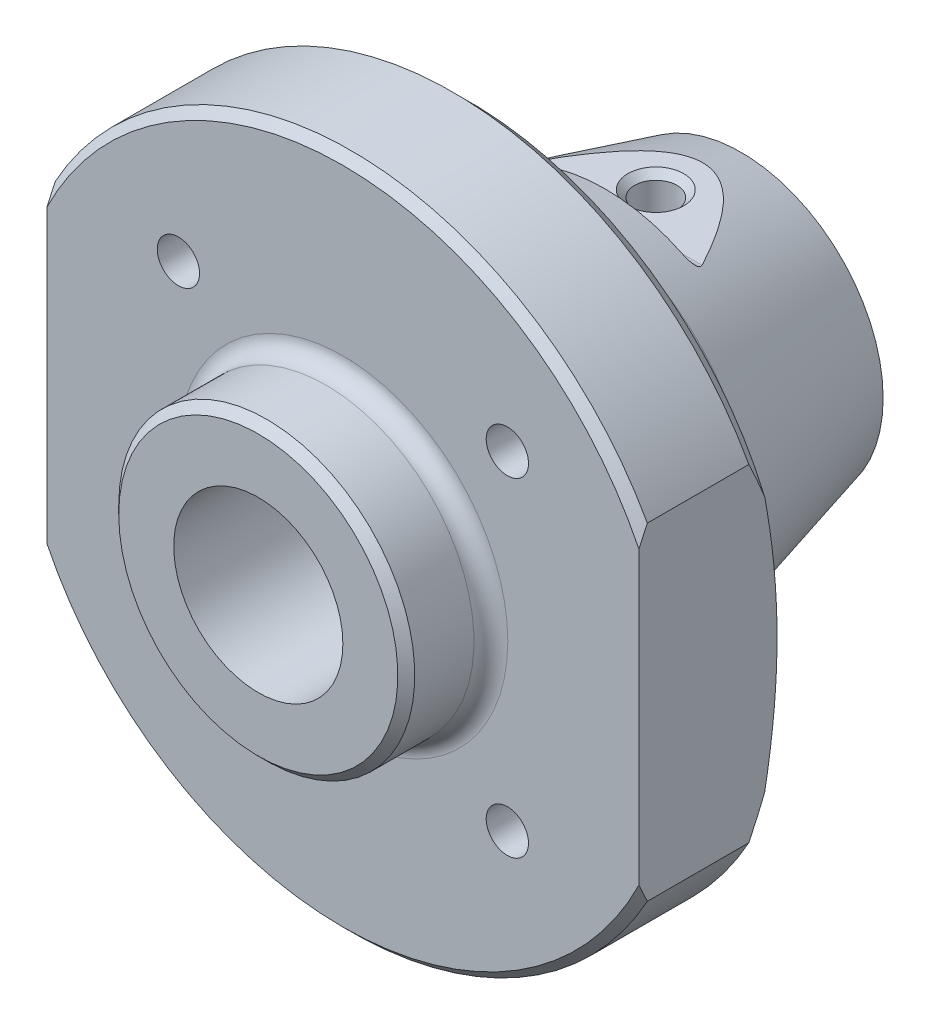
SolidWorks part; units mm, degrees
ref_plane "Front" through (0, 0, 0) normal (0, 0, 1) x (1, 0, 0)
ref_plane "Top" through (0, 0, 0) normal (0, 1, 0) x (1, 0, 0)
ref_plane "Right" through (0, 0, 0) normal (1, 0, 0) x (0, 0, -1)
sketch "Sketch2" plane through (0, 0, 0) normal (0, 1, 0) x (1, 0, 0)
  line L0 (0, 0) -> (0, -23.293) construction
  line L1 (0, 0) -> (17.5, 0)
  line L2 (40, 10) -> (40, 24)
  line L3 (40, 24) -> (23.5966, 31.649)
  line L4 (23.5966, 31.649) -> (16, 60)
  line L5 (16, 60) -> (0, 60)
  line L6 (0, 60) -> (0, 0)
  line L10 (40, 10) -> (17.5, 10)
  line L11 (17.5, 0) -> (17.5, 10)
  dimension "D1" = 80
  dimension "D2" = 35
  dimension "D3" = 65
  dimension "D4" = 32
  dimension "D5" = 60
  dimension "D6" = 75
  dimension "D7" = 10
  dimension "D8" = 24
revolve "Revolve1" add sketch "Sketch2" angle 360 about L0
sketch "Sketch3" plane through (0, 0, -10) normal (0, 0, 1) x (1, 0, 0)
  line L1 (-35, 45) -> (35, 45)
  line L2 (-35, 45) -> (-35, -45)
  line L3 (-35, -45) -> (35, -45)
  line L4 (35, 45) -> (35, -45)
  line L5 (-35, 45) -> (35, -45) construction
  line L6 (-35, -45) -> (35, 45) construction
  point P0 (0, 0)
  dimension "D1" = 70
  dimension "D2" = 90
extrude "Cut-Extrude1" cut sketch "Sketch3" against normal through all flip side to cut
hole_wizard "M6 Tapped Hole1" positions "Sketch5" profile "Sketch4" tap size "M6" standard "ISO"
sketch "Sketch5" plane through (0, 0, -10) normal (0, 0, 1) x (1, 0, 0)
  line L0 (0, 40) -> (0, 0) construction
  line L1 (0, 0) -> (19.4454, 19.4454) construction
  circle A0 centre (0, 0) radius 27.5 construction
  arc A1 (35, 19.3649) -> (-35, 19.3649) centre (0, 0) ccw construction
  point P0 (19.4454, 19.4454)
  dimension "D1" = 55
  dimension "D2" = 45
sketch "Sketch4" plane through (19.4454, 19.4454, -10) normal (1, 0, 0) x (0, -1, 0)
  line L0 (0, 0) -> (0, 16.5022)
  line L1 (0, 16.5022) -> (2.5, 15)
  line L2 (2.5, 15) -> (2.5, 0)
  line L5 (2.5, 0) -> (0, 0)
  line L10 (0, 16.5022) -> (-2.5, 15) construction
  line L11 (0, -6.35) -> (0, 107.95) construction
  dimension "Tap Drill Dia." = 5
  dimension "Tap Drill Depth" = 15
  dimension "Drill Angle" = 118
pattern_circular "CirPattern1" count 4 over 360 about axis through (0, 0, 0) along (0, 0, 1) of "M6 Tapped Hole1"
sketch "Sketch6" plane through (0, 0, 0) normal (0, 0, 1) x (1, 0, 0)
  circle A0 centre (0, 0) radius 10
  dimension "D1" = 20
extrude "Cut-Extrude2" cut sketch "Sketch6" against normal blind 50
fillet "Fillet1" radius 10 1 edges at (-23.5966, 0, -31.649)
chamfer "Chamfer1" distance 3 angle 45 1 edges at (-16, 0, -60)
chamfer "Chamfer2" distance 1 angle 45 4 edges at (0, 40, -10) (0, -40, -10) (0, -40, -24) (0, 40, -24)
chamfer "Chamfer3" distance 1 angle 45 1 edges at (-17.5, 0, 0)
fillet "Fillet3" radius 2 1 edges at (-17.5, 0, -10)
sketch "Sketch8" plane through (0, 0, 0) normal (1, 0, 0) x (0, 0, -1)
  line L0 (60, 18) -> (42, 18)
  line L1 (0, 0) -> (60, 0) construction
  line L2 (0, 16.5) -> (0, -16.5) construction
  line L3 (60, -11.7574) -> (60, 11.7574) construction
  line L4 (41, 19) -> (42, 19) construction
  line L5 (42, 19) -> (42, 18) construction
  line L6 (41, 19) -> (41, 24)
  arc A0 (42, 18) -> (41, 19) centre (42, 19) cw
  dimension "D3" = 1
  dimension "D1" = 18
  dimension "D2" = 18
  dimension "D4" = 6
extrude "Cut-Extrude3" cut sketch "Sketch8" against normal through all and the other way through all flip side to cut
sketch "Sketch9" plane through (0, 18, 0) normal (0, 1, 0) x (1, 0, 0)
  line L0 (11.7574, 60) -> (-11.7574, 60) construction
  circle A0 centre (0, 47) radius 2.5
  dimension "D1" = 5
  dimension "D2" = 13
extrude "Cut-Extrude4" cut sketch "Sketch9" against normal up to surface (8 mm away)
chamfer "Chamfer4" distance 0.8 angle 45 1 edges at (0, 18, -44.5)
